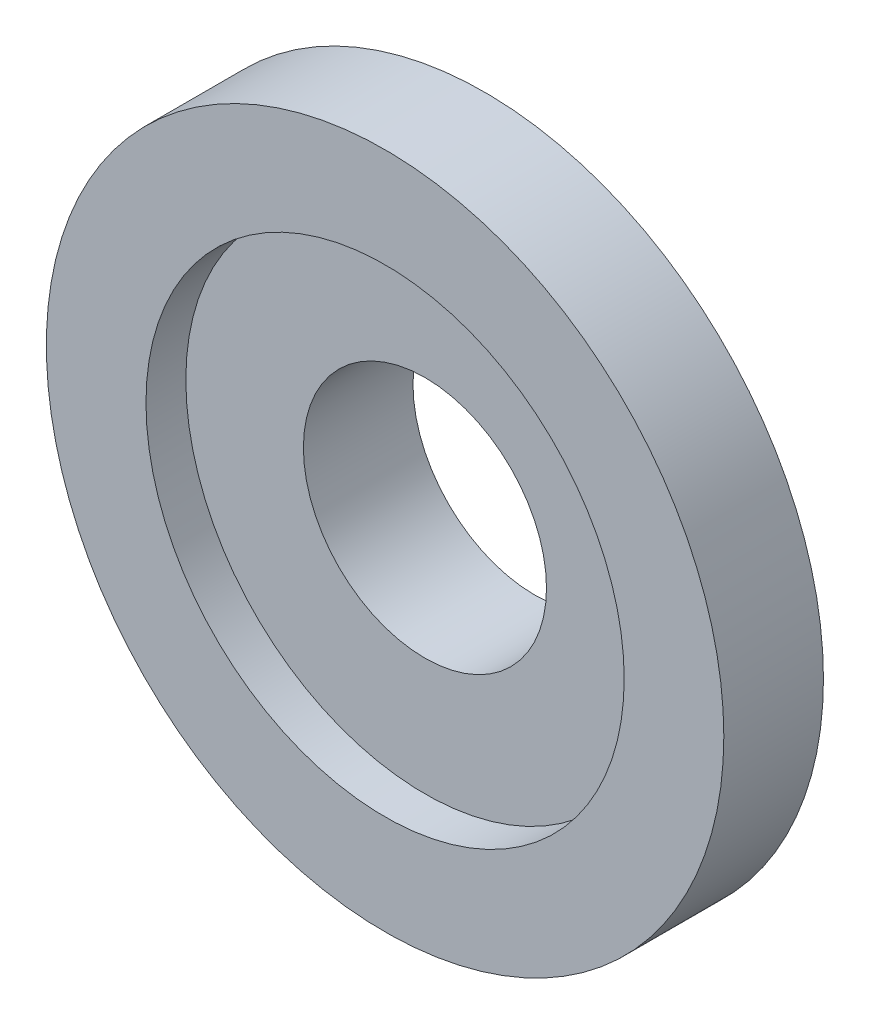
SolidWorks part; units mm, degrees
ref_plane "前视基准面" through (0, 0, 0) normal (0, 0, 1) x (1, 0, 0)
ref_plane "上视基准面" through (0, 0, 0) normal (0, 1, 0) x (1, 0, 0)
ref_plane "右视基准面" through (0, 0, 0) normal (1, 0, 0) x (0, 0, -1)
other "Configuration Table"
sketch "草图1" plane through (0, 0, 0) normal (0, 0, 1) x (1, 0, 0)
  circle A0 centre (0, 0) radius 17
  dimension "D1" = 34
extrude "凸台-拉伸1" add sketch "草图1" along normal blind 3
sketch "草图2" plane through (0, 0, 0) normal (0, 0, -1) x (-1, 0, 0)
  circle A0 centre (0, 0) radius 6.1
  circle A1 centre (0, 0) radius 7.5
  dimension "D1" = 12.2
  dimension "D2" = 15
extrude "凸台-拉伸2" add sketch "草图2" along normal blind 2.5
sketch "草图3" plane through (0, 0, -2.5) normal (0, 0, -1) x (-1, 0, 0)
  circle A0 centre (0, 0) radius 6.1
extrude "切除-拉伸1" cut sketch "草图3" against normal through all
sketch "草图4" plane through (0, 0, 0) normal (0, 0, -1) x (-1, 0, 0)
  circle A0 centre (0, 0) radius 12
  circle A1 centre (0, 0) radius 10
  dimension "D1" = 20
  dimension "D2" = 24
extrude "切除-拉伸2" cut sketch "草图4" against normal blind 0.2
sketch "草图5" plane through (0, 0, 3) normal (0, 0, 1) x (1, 0, 0)
  circle A0 centre (0, 0) radius 12
  circle A1 centre (0, 0) radius 17
  dimension "D1" = 24
extrude "凸台-拉伸3" add sketch "草图5" along normal blind 2
